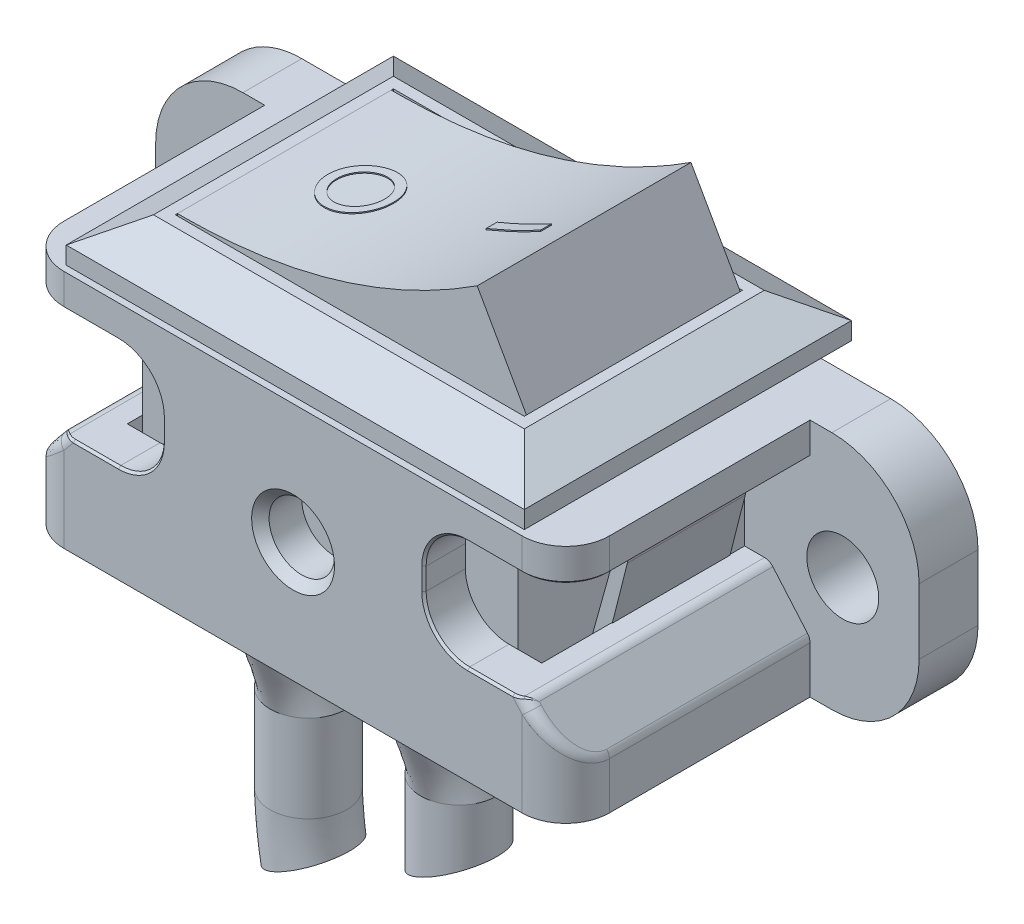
SolidWorks part; units mm, degrees
ref_plane "前视基准面" through (0, 0, 0) normal (0, 0, 1) x (1, 0, 0)
ref_plane "上视基准面" through (0, 0, 0) normal (0, 1, 0) x (1, 0, 0)
ref_plane "右视基准面" through (0, 0, 0) normal (1, 0, 0) x (0, 0, -1)
imported_body "开关组件-1/开关座-1-solid1"
imported_body "开关组件-1/开关-1-solid1"
imported_body "中心板电源插座V2V4-V5-CV7-1/复件 复件 装配体1^中心板电源插座V2V4-V5-CV7-1/I2C PIN脚V2V4-V5-C-V6-1-solid1"
imported_body "中心板电源插座V2V4-V5-CV7-1/复件 复件 装配体1^中心板电源插座V2V4-V5-CV7-1/I2C PIN脚V2V4-V5-C-V6-2-solid1"
imported_body "中心板电源插座V2V4-V5-CV7-1/复件 复件 装配体1^中心板电源插座V2V4-V5-CV7-1/WM610_插座铜片V2V4-V5-C-V6-1-solid1"
imported_body "中心板电源插座V2V4-V5-CV7-1/复件 复件 装配体1^中心板电源插座V2V4-V5-CV7-1/I2C PIN脚V2V4-V5-C-V6-3-solid1"
imported_body "中心板电源插座V2V4-V5-CV7-1/复件 复件 装配体1^中心板电源插座V2V4-V5-CV7-1/I2C PIN脚V2V4-V5-C-V6-4-solid1"
imported_body "中心板电源插座V2V4-V5-CV7-1/复件 复件 装配体1^中心板电源插座V2V4-V5-CV7-1/WM610_插座铜片（正极）V2V4-V5-C-V6-1-solid1"
imported_body "中心板电源插座V2V4-V5-CV7-1/复件 复件 装配体1^中心板电源插座V2V4-V5-CV7-1/wm610_cb_v7-C-V6-1-solid1"
imported_body "中心板电源插座V2V4-V5-CV7-1/复件 复件 装配体1^中心板电源插座V2V4-V5-CV7-1/电源插座V2V4-V5-V6-1-solid1"
imported_body "电池架V3-1-solid1"
imported_body "电池架绝缘片-1-solid1"
imported_body "电池架绝缘片-1-solid2"
imported_body "电池架绝缘片-1-solid3"
imported_body "jst插头-1-solid1"
sketch "草图1" plane through (66.5, 0, 0) normal (1, 0, 0) x (0, 0, -1)
  line L0 (-27.7, 3) -> (-26.2, 3)
  line L1 (-24.7, 3) -> (-27.7, 3) construction
  line L2 (-26.2, 3) -> (-26.3, 3.8)
  line L3 (-26.3, 3.8) -> (-28.3, 5)
  line L4 (-28.3, 5) -> (-28.3, 12.0302)
  line L5 (-28.3, 12.0302) -> (-43.7459, 12.0302)
  line L6 (-43.7459, 12.0302) -> (-43.7459, -31.6066)
  line L7 (-43.7459, -31.6066) -> (-27.3, -31.6066)
  line L8 (-27.3, -31.6066) -> (-27.3, -8.5)
  line L9 (-27.7, -8.5) -> (-26.5, -8.5) construction
  line L10 (-27.3, -8.5) -> (-27.7, -8.5)
  line L11 (-27.7, -8.5) -> (-27.7, 3)
  line L13 (-66.6769, 28.5723) -> (43.282, 28.5723)
  line L14 (-66.6769, 28.5723) -> (-66.6769, -53.9697)
  line L15 (-66.6769, -53.9697) -> (43.282, -53.9697)
  line L16 (43.282, 28.5723) -> (43.282, -53.9697)
extrude "切除-拉伸1" cut sketch "草图1" against normal mid plane 222
sketch "草图2" plane through (0, 0, 27.9) normal (0, 0, -1) x (-1, 0, 0)
  line L0 (-68.3762, -9.7247) -> (-68.3762, 1.316)
  line L1 (-68.3762, 1.316) -> (-61.8742, 4.6587)
  line L2 (-61.8742, 4.6587) -> (-57.4624, 11.878)
  line L3 (-57.4624, 11.878) -> (-35.6039, 11.3967)
  line L4 (-35.6039, 11.3967) -> (-32.9344, 2.7348)
  line L5 (-32.9344, 2.7348) -> (-23.82, -5.6862)
  line L6 (-23.82, -5.6862) -> (-32.9344, -26.3824)
  line L7 (-32.9344, -26.3824) -> (-68.3762, -9.7247)
  line L9 (-125.1118, 42.6267) -> (21.142, 42.6267)
  line L10 (-125.1118, 42.6267) -> (-125.1118, -56.7691)
  line L11 (-125.1118, -56.7691) -> (21.142, -56.7691)
  line L12 (21.142, 42.6267) -> (21.142, -56.7691)
extrude "切除-拉伸2" cut sketch "草图2" against normal mid plane 162
